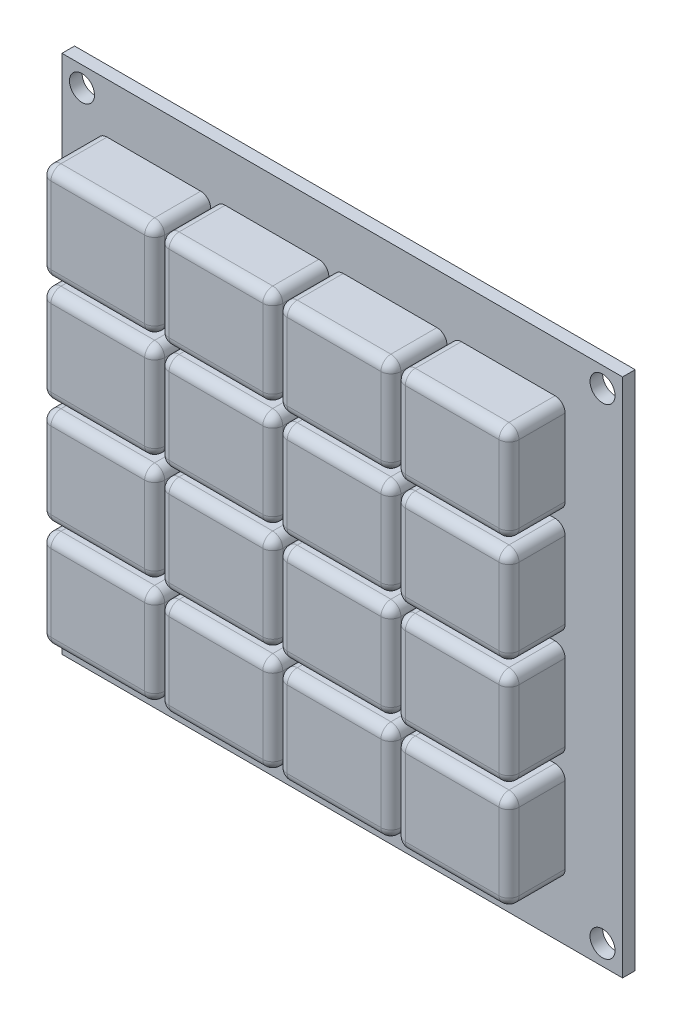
SolidWorks part; units mm, degrees
ref_plane "Front" through (0, 0, 0) normal (0, 0, 1) x (1, 0, 0)
ref_plane "Top" through (0, 0, 0) normal (0, 1, 0) x (1, 0, 0)
ref_plane "Right" through (0, 0, 0) normal (1, 0, 0) x (0, 0, -1)
sketch "Sketch1" plane through (0, 0, 0) normal (0, 0, 1) x (1, 0, 0)
  line L0 (-35.56, -33.02) -> (35.56, 33.02) construction
  line L1 (-35.56, 33.02) -> (35.56, 33.02)
  line L2 (-35.56, 33.02) -> (-35.56, -33.02)
  line L3 (-35.56, -33.02) -> (35.56, -33.02)
  line L4 (35.56, 33.02) -> (35.56, -33.02)
  dimension "D1" = 66.04
  dimension "D2" = 71.12
extrude "Base-Extrude" add sketch "Sketch1" against normal blind 1.6002
sketch "Sketch2" plane through (0, 0, 0) normal (0, 0, 1) x (1, 0, 0)
  line L0 (-35.56, 33.02) -> (-35.56, -33.02) construction
  line L1 (-31.115, 26.67) -> (-16.6878, 26.67)
  line L2 (-31.115, 26.67) -> (-31.115, 14.4018)
  line L3 (-31.115, 14.4018) -> (-16.6878, 14.4018)
  line L4 (-16.6878, 26.67) -> (-16.6878, 14.4018)
  line L5 (35.56, 33.02) -> (-35.56, 33.02) construction
  dimension "D1" = 12.2682
  dimension "D2" = 14.4272
  dimension "D3" = 4.445
  dimension "D4" = 6.35
extrude "Boss-Extrude1" add sketch "Sketch2" along normal blind 7.112
fillet "Fillet1" radius 1.27
pattern_linear "LPattern1" count 4 spacing 14.986 count 4 spacing 13.462
sketch "Sketch3" plane through (0, 0, 0) normal (0, 0, 1) x (1, 0, 0)
  line L0 (-35.56, 0) -> (35.56, 0) construction
  line L1 (-35.56, 33.02) -> (-35.56, -33.02) construction
  line L2 (35.56, -33.02) -> (35.56, 33.02) construction
  line L3 (0, 33.02) -> (0, -33.02) construction
  line L4 (35.56, 33.02) -> (-35.56, 33.02) construction
  line L5 (-35.56, -33.02) -> (35.56, -33.02) construction
  circle A0 centre (-33.02, 30.48) radius 1.5875
  circle A1 centre (-33.02, -30.48) radius 1.5875
  circle A2 centre (33.02, -30.48) radius 1.5875
  circle A3 centre (33.02, 30.48) radius 1.5875
  dimension "D1" = 3.175
  dimension "D2" = 66.04
  dimension "D3" = 60.96
extrude "Cut-Extrude1" cut sketch "Sketch3" against normal through all
sketch "Sketch4" plane through (0, 0, 0) normal (0, 0, 1) x (1, 0, 0)
  line L0 (-35.56, 0) -> (35.56, 0) construction
  line L2 (-35.56, 33.02) -> (-35.56, -33.02) construction
  line L3 (35.56, -33.02) -> (35.56, 33.02) construction
  circle A0 centre (-33.655, 2.54) radius 0.635
  circle A1 centre (-33.655, -2.54) radius 0.635
  dimension "D1" = 1.27
  dimension "D2" = 5.08
  dimension "D3" = 1.905
extrude "Cut-Extrude2" cut sketch "Sketch4" against normal through all
sketch "Sketch5" plane through (-38.6013, 39.4093, 0) normal (0, 0, 1) x (0, 1, 0)
  text T0 "CONNECTIONS" font "Century Gothic" height in points 6
extrude "Boss-Extrude2" add sketch "Sketch5" along normal blind 0.0508
